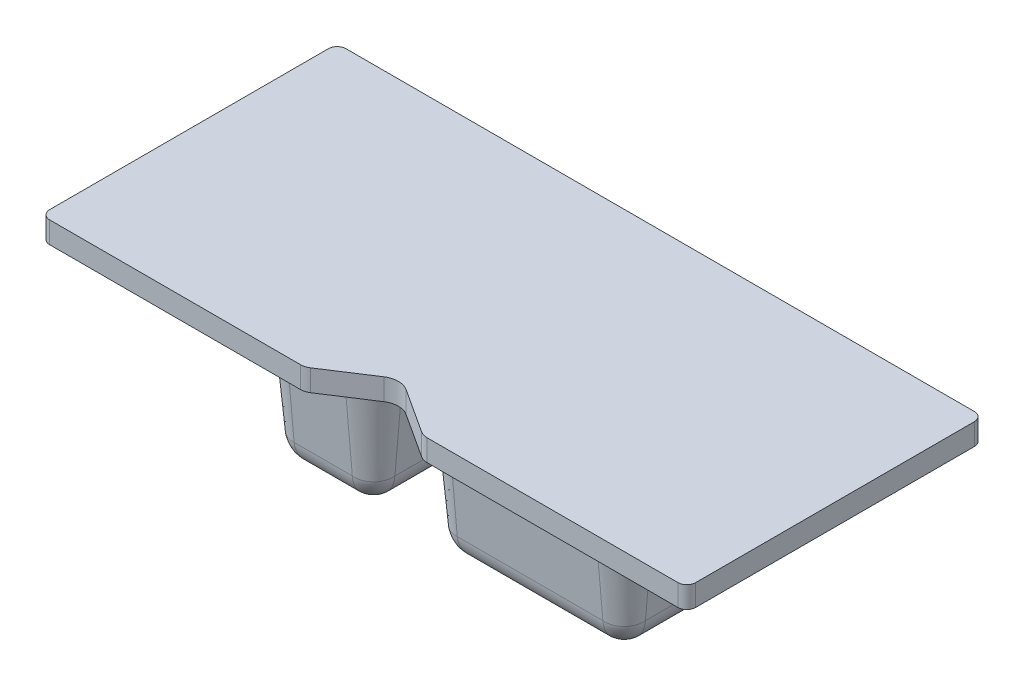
SolidWorks part; units mm, degrees
ref_plane "Front Plane" through (0, 0, 0) normal (0, 0, 1) x (1, 0, 0)
ref_plane "Top Plane" through (0, 0, 0) normal (0, 1, 0) x (1, 0, 0)
ref_plane "Right Plane" through (0, 0, 0) normal (1, 0, 0) x (0, 0, -1)
sketch "Sketch1" plane through (0, 0, 0) normal (0, 1, 0) x (1, 0, 0)
  line L1 (-560, 280) -> (560, 280)
  line L2 (-580, 260) -> (-580, -260)
  line L3 (-560, -280) -> (560, -280)
  line L4 (580, 260) -> (580, -260)
  line L5 (-580, 280) -> (580, -280) construction
  line L6 (-580, -280) -> (580, 280) construction
  arc A0 (560, 280) -> (580, 260) centre (560, 260) cw
  arc A1 (-580, -260) -> (-560, -280) centre (-560, -260) ccw
  arc A2 (-560, 280) -> (-580, 260) centre (-560, 260) ccw
  arc A3 (560, -280) -> (580, -260) centre (560, -260) ccw
  point P0 (0, 0)
  dimension "D3" = 20
  dimension "D1" = 560
  dimension "D2" = 1160
extrude "Boss-Extrude1" add sketch "Sketch1" against normal blind 5 draft 45
sketch "Sketch2" plane through (0, 0, 0) normal (0, 1, 0) x (1, 0, 0)
  line L1 (-600, 300) -> (600, 300)
  line L2 (-600, 300) -> (-600, -300)
  line L3 (-600, -300) -> (600, -300)
  line L4 (600, 300) -> (600, -300)
  line L5 (-600, 300) -> (600, -300) construction
  line L6 (-600, -300) -> (600, 300) construction
  point P0 (0, 0)
  dimension "D1" = 600
  dimension "D2" = 1200
extrude "Boss-Extrude2" add sketch "Sketch2" along normal blind 28
fillet "Fillet1" radius 2 16 edges at (-574.1421, 0, 274.1421) (-580, 0, 0) (-574.1421, 0, -274.1421) (0, 0, -280) (574.1421, 0, -274.1421) (580, 0, 0) (574.1421, 0, 274.1421) (0, -5, -275) (-570.6066, -5, -270.6066) (-575, -5, 0) (-570.6066, -5, 270.6066) (0, -5, 275) (570.6066, -5, 270.6066) (575, -5, 0) (570.6066, -5, -270.6066) (0, 0, 280)
sketch "Sketch5" plane through (0, -5, 0) normal (0, -1, 0) x (1, 0, 0)
  line L4 (-560, -274.1716) -> (560, -274.1716)
  line L5 (574.1716, -260) -> (574.1716, 260)
  line L6 (560, 274.1716) -> (-560, 274.1716)
  line L7 (-574.1716, 260) -> (-574.1716, -260)
  line L8 (-560, -274.1716) -> (560, -274.1716)
  line L9 (574.1716, -260) -> (574.1716, 260)
  line L10 (560, 274.1716) -> (-560, 274.1716)
  line L11 (-574.1716, 260) -> (-574.1716, -260)
  arc A4 (-574.1716, -260) -> (-560, -274.1716) centre (-560, -260) ccw
  arc A5 (560, -274.1716) -> (574.1716, -260) centre (560, -260) ccw
  arc A6 (574.1716, 260) -> (560, 274.1716) centre (560, 260) ccw
  arc A7 (-560, 274.1716) -> (-574.1716, 260) centre (-560, 260) ccw
  arc A8 (-574.1716, -260) -> (-560, -274.1716) centre (-560, -260) ccw
  arc A9 (560, -274.1716) -> (574.1716, -260) centre (560, -260) ccw
  arc A10 (574.1716, 260) -> (560, 274.1716) centre (560, 260) ccw
  arc A11 (-560, 274.1716) -> (-574.1716, 260) centre (-560, 260) ccw
  dimension "D1" = 0
extrude "Cut-Extrude1" cut sketch "Sketch5" against normal through all flip side to cut
sketch "Sketch6" plane through (0, -5, 0) normal (0, -1, 0) x (1, 0, 0)
  line L0 (-574.1716, 260) -> (-574.1716, -260) construction
  line L1 (539.1716, 259.1716) -> (108.8932, 259.1716)
  line L2 (559.1716, 239.1716) -> (559.1716, -239.1716)
  line L3 (539.1716, -259.1716) -> (-539.1716, -259.1716)
  line L4 (-559.1716, 239.1716) -> (-559.1716, -239.1716)
  line L5 (559.1716, 259.1716) -> (-559.1716, -259.1716) construction
  line L6 (559.1716, -259.1716) -> (-559.1716, 259.1716) construction
  line L7 (560, 274.1716) -> (-560, 274.1716) construction
  line L8 (0, 0) -> (0, 259.1716) construction
  line L9 (92.5436, 254.3249) -> (16.3497, 204.7988)
  line L10 (-16.3497, 204.7988) -> (-92.5436, 254.3249)
  line L11 (-108.8932, 259.1716) -> (-539.1716, 259.1716)
  arc A0 (-539.1716, 259.1716) -> (-559.1716, 239.1716) centre (-539.1716, 239.1716) ccw
  arc A1 (559.1716, -239.1716) -> (539.1716, -259.1716) centre (539.1716, -239.1716) cw
  arc A2 (539.1716, 259.1716) -> (559.1716, 239.1716) centre (539.1716, 239.1716) cw
  arc A3 (-539.1716, -259.1716) -> (-559.1716, -239.1716) centre (-539.1716, -239.1716) cw
  arc A4 (16.3497, 204.7988) -> (-16.3497, 204.7988) centre (0, 229.9522) cw
  arc A5 (92.5436, 254.3249) -> (108.8932, 259.1716) centre (108.8932, 229.1716) cw
  arc A6 (-92.5436, 254.3249) -> (-108.8932, 259.1716) centre (-108.8932, 229.1716) ccw
  point P0 (0, 0)
  point P29 (0, 194.1716)
  point P32 (100, 259.1716)
  point P35 (-100, 259.1716)
  dimension "D3" = 20
  dimension "D6" = 30
  dimension "D7" = 30
  dimension "D1" = 15
  dimension "D2" = 15
  dimension "D4" = 200
  dimension "D5" = 65
extrude "Boss-Extrude3" add sketch "Sketch6" along normal blind 4 draft 45
fillet "Fillet2" radius 2 28 edges at (553.3137, -5, 253.3137) (559.1716, -5, 0) (553.3137, -5, -253.3137) (0, -5, -259.1716) (-553.3137, -5, -253.3137) (-559.1716, -5, 0) (-553.3137, -5, 253.3137) (-324.0324, -5, 259.1716) (-100.3668, -5, 257.9344) (-54.4466, -5, 229.5619) (0, -5, 199.9522) (54.4466, -5, 229.5619) (100.3668, -5, 257.9344) (-324.0324, -9, 255.1716) (-101.5036, -9, 254.0993) (-56.6266, -9, 226.2081) (0, -9, 195.9522) (56.6266, -9, 226.2081) (101.5036, -9, 254.0993) (324.0324, -9, 255.1716) (550.4853, -9, 250.4853) (555.1716, -9, 0) (550.4853, -9, -250.4853) (0, -9, -255.1716) (-550.4853, -9, -250.4853) (-555.1716, -9, 0) (-550.4853, -9, 250.4853) (324.0324, -5, 259.1716)
sketch "Sketch8" plane through (0, -9, 0) normal (0, -1, 0) x (1, 0, 0)
  line L7 (-108.8932, 254.3431) -> (-539.1716, 254.3431)
  line L8 (-554.3431, 239.1716) -> (-554.3431, -239.1716)
  line L9 (-539.1716, -254.3431) -> (539.1716, -254.3431)
  line L10 (554.3431, -239.1716) -> (554.3431, 239.1716)
  line L11 (539.1716, 254.3431) -> (108.8932, 254.3431)
  line L12 (95.175, 250.2765) -> (18.9811, 200.7505)
  line L13 (-18.9811, 200.7505) -> (-95.175, 250.2765)
  line L14 (-108.8932, 254.3431) -> (-539.1716, 254.3431)
  line L15 (-554.3431, 239.1716) -> (-554.3431, -239.1716)
  line L16 (-539.1716, -254.3431) -> (539.1716, -254.3431)
  line L17 (554.3431, -239.1716) -> (554.3431, 239.1716)
  line L18 (539.1716, 254.3431) -> (108.8932, 254.3431)
  line L19 (95.175, 250.2765) -> (18.9811, 200.7505)
  line L20 (-18.9811, 200.7505) -> (-95.175, 250.2765)
  arc A7 (-95.175, 250.2765) -> (-108.8932, 254.3431) centre (-108.8932, 229.1716) ccw
  arc A8 (-539.1716, 254.3431) -> (-554.3431, 239.1716) centre (-539.1716, 239.1716) ccw
  arc A9 (-554.3431, -239.1716) -> (-539.1716, -254.3431) centre (-539.1716, -239.1716) ccw
  arc A10 (539.1716, -254.3431) -> (554.3431, -239.1716) centre (539.1716, -239.1716) ccw
  arc A11 (554.3431, 239.1716) -> (539.1716, 254.3431) centre (539.1716, 239.1716) ccw
  arc A12 (108.8932, 254.3431) -> (95.175, 250.2765) centre (108.8932, 229.1716) ccw
  arc A13 (-18.9811, 200.7505) -> (18.9811, 200.7505) centre (0, 229.9522) ccw
  arc A14 (-95.175, 250.2765) -> (-108.8932, 254.3431) centre (-108.8932, 229.1716) ccw
  arc A15 (-539.1716, 254.3431) -> (-554.3431, 239.1716) centre (-539.1716, 239.1716) ccw
  arc A16 (-554.3431, -239.1716) -> (-539.1716, -254.3431) centre (-539.1716, -239.1716) ccw
  arc A17 (539.1716, -254.3431) -> (554.3431, -239.1716) centre (539.1716, -239.1716) ccw
  arc A18 (554.3431, 239.1716) -> (539.1716, 254.3431) centre (539.1716, 239.1716) ccw
  arc A19 (108.8932, 254.3431) -> (95.175, 250.2765) centre (108.8932, 229.1716) ccw
  arc A20 (-18.9811, 200.7505) -> (18.9811, 200.7505) centre (0, 229.9522) ccw
  dimension "D1" = 0
extrude "Cut-Extrude2" cut sketch "Sketch8" against normal through all flip side to cut
sketch "Sketch9" plane through (0, -9, 0) normal (0, -1, 0) x (1, 0, 0)
  line L1 (340, 197.5) -> (90, 197.5)
  line L2 (390, 147.5) -> (390, -147.5)
  line L3 (340, -197.5) -> (90, -197.5)
  line L4 (40, 147.5) -> (40, -147.5)
  line L5 (390, 197.5) -> (40, -197.5) construction
  line L6 (390, -197.5) -> (40, 197.5) construction
  line L7 (-190, 197.5) -> (-90, 197.5)
  line L8 (-240, 147.5) -> (-240, -147.5)
  line L9 (-190, -197.5) -> (-90, -197.5)
  line L10 (-40, 147.5) -> (-40, -147.5)
  line L11 (-240, 197.5) -> (-40, -197.5) construction
  line L12 (-240, -197.5) -> (-40, 197.5) construction
  arc A0 (90, 197.5) -> (40, 147.5) centre (90, 147.5) ccw
  arc A1 (390, -147.5) -> (340, -197.5) centre (340, -147.5) cw
  arc A2 (340, 197.5) -> (390, 147.5) centre (340, 147.5) cw
  arc A3 (90, -197.5) -> (40, -147.5) centre (90, -147.5) cw
  arc A4 (-90, 197.5) -> (-40, 147.5) centre (-90, 147.5) cw
  arc A5 (-240, -147.5) -> (-190, -197.5) centre (-190, -147.5) ccw
  arc A6 (-190, 197.5) -> (-240, 147.5) centre (-190, 147.5) ccw
  arc A7 (-90, -197.5) -> (-40, -147.5) centre (-90, -147.5) ccw
  point P0 (215, 0)
  point P18 (-140, 0)
  dimension "D4" = 50
  dimension "D8" = 50
  dimension "D1" = 350
  dimension "D2" = 395
  dimension "D3" = 40
  dimension "D5" = 200
  dimension "D6" = 395
  dimension "D7" = 40
extrude "Boss-Extrude4" add sketch "Sketch9" along normal blind 200 draft 5
fillet "Fillet3" radius 50 8 edges at (-57.4977, -209, 0) (-140, -209, -180.0023) (-222.5023, -209, 0) (-140, -209, 180.0023) (215, -209, 180.0023) (372.5023, -209, 0) (215, -209, -180.0023) (57.4977, -209, 0)
sketch "Sketch10" plane through (0, -209, 0) normal (0, -1, 0) x (1, 0, 0)
  line L0 (215, 0) -> (215, -134.1857) construction
  line L1 (103.3143, -134.1857) -> (326.6857, -134.1857) construction
  line L2 (-140, -134.1857) -> (-140, 0) construction
  line L3 (-176.6857, -134.1857) -> (-103.3143, -134.1857) construction
  circle A0 centre (215, 0) radius 30
  circle A1 centre (-140, 0) radius 30
  dimension "D1" = 60
extrude "Boss-Extrude5" add sketch "Sketch10" along normal blind 10
fillet "Fillet4" radius 3 3 edges at (-140, -209, 30) (215, -209, -30) (215, -219, -30)
fillet "Fillet5" radius 20 16 edges at (40, -9, 0) (54.6447, -9, 182.8553) (215, -9, 197.5) (375.3553, -9, 182.8553) (390, -9, 0) (375.3553, -9, -182.8553) (215, -9, -197.5) (-140, -9, -197.5) (-225.3553, -9, -182.8553) (-240, -9, 0) (-225.3553, -9, 182.8553) (-140, -9, 197.5) (-54.6447, -9, 182.8553) (-40, -9, 0) (54.6447, -9, -182.8553) (-54.6447, -9, -182.8553)
sketch "Orientation Sketch" plane through (0, -9, 0) normal (0, -1, 0) x (-1, 0, 0)
  line L0 (-21.6734, 147.5) -> (-21.6734, -147.5) construction
  line L1 (-90, -215.8266) -> (-340, -215.8266) construction
  line L2 (-408.3266, -147.5) -> (-408.3266, 147.5) construction
  line L3 (-340, 215.8266) -> (-90, 215.8266) construction
  line L4 (90, 215.8266) -> (190, 215.8266) construction
  line L5 (258.3266, 147.5) -> (258.3266, -147.5) construction
  line L6 (190, -215.8266) -> (90, -215.8266) construction
  line L7 (21.6734, -147.5) -> (21.6734, 147.5) construction
  line L8 (108.8932, -254.3431) -> (539.1716, -254.3431) construction
  line L9 (554.3431, -239.1716) -> (554.3431, 239.1716) construction
  line L10 (539.1716, 254.3431) -> (-539.1716, 254.3431) construction
  line L11 (-554.3431, 239.1716) -> (-554.3431, -239.1716) construction
  line L12 (-539.1716, -254.3431) -> (-108.8932, -254.3431) construction
  line L13 (-95.175, -250.2765) -> (-18.9811, -200.7505) construction
  line L14 (18.9811, -200.7505) -> (95.175, -250.2765) construction
  line L15 (-21.6734, 147.5) -> (-21.6734, -147.5)
  line L16 (-90, -215.8266) -> (-340, -215.8266)
  line L17 (-408.3266, -147.5) -> (-408.3266, 147.5)
  line L18 (-340, 215.8266) -> (-90, 215.8266)
  line L19 (90, 215.8266) -> (190, 215.8266)
  line L20 (258.3266, 147.5) -> (258.3266, -147.5)
  line L21 (190, -215.8266) -> (90, -215.8266)
  line L22 (21.6734, -147.5) -> (21.6734, 147.5)
  line L23 (108.8932, -254.3431) -> (539.1716, -254.3431) construction
  line L24 (554.3431, -239.1716) -> (554.3431, 239.1716) construction
  line L25 (539.1716, 254.3431) -> (-539.1716, 254.3431) construction
  line L26 (-554.3431, 239.1716) -> (-554.3431, -239.1716) construction
  line L27 (-539.1716, -254.3431) -> (-108.8932, -254.3431) construction
  line L28 (-95.175, -250.2765) -> (-18.9811, -200.7505) construction
  line L29 (18.9811, -200.7505) -> (95.175, -250.2765) construction
  arc A0 (-21.6734, 147.5) -> (-90, 215.8266) centre (-90, 147.5) ccw construction
  arc A1 (-90, -215.8266) -> (-21.6734, -147.5) centre (-90, -147.5) ccw construction
  arc A2 (-408.3266, -147.5) -> (-340, -215.8266) centre (-340, -147.5) ccw construction
  arc A3 (-340, 215.8266) -> (-408.3266, 147.5) centre (-340, 147.5) ccw construction
  arc A4 (90, 215.8266) -> (21.6734, 147.5) centre (90, 147.5) ccw construction
  arc A5 (258.3266, 147.5) -> (190, 215.8266) centre (190, 147.5) ccw construction
  arc A6 (190, -215.8266) -> (258.3266, -147.5) centre (190, -147.5) ccw construction
  arc A7 (21.6734, -147.5) -> (90, -215.8266) centre (90, -147.5) ccw construction
  arc A8 (95.175, -250.2765) -> (108.8932, -254.3431) centre (108.8932, -229.1716) ccw construction
  arc A9 (539.1716, -254.3431) -> (554.3431, -239.1716) centre (539.1716, -239.1716) ccw construction
  arc A10 (554.3431, 239.1716) -> (539.1716, 254.3431) centre (539.1716, 239.1716) ccw construction
  arc A11 (-539.1716, 254.3431) -> (-554.3431, 239.1716) centre (-539.1716, 239.1716) ccw construction
  arc A12 (-554.3431, -239.1716) -> (-539.1716, -254.3431) centre (-539.1716, -239.1716) ccw construction
  arc A13 (-108.8932, -254.3431) -> (-95.175, -250.2765) centre (-108.8932, -229.1716) ccw construction
  arc A14 (18.9811, -200.7505) -> (-18.9811, -200.7505) centre (0, -229.9522) ccw construction
  arc A15 (-21.6734, 147.5) -> (-90, 215.8266) centre (-90, 147.5) ccw
  arc A16 (-90, -215.8266) -> (-21.6734, -147.5) centre (-90, -147.5) ccw
  arc A17 (-408.3266, -147.5) -> (-340, -215.8266) centre (-340, -147.5) ccw
  arc A18 (-340, 215.8266) -> (-408.3266, 147.5) centre (-340, 147.5) ccw
  arc A19 (90, 215.8266) -> (21.6734, 147.5) centre (90, 147.5) ccw
  arc A20 (258.3266, 147.5) -> (190, 215.8266) centre (190, 147.5) ccw
  arc A21 (190, -215.8266) -> (258.3266, -147.5) centre (190, -147.5) ccw
  arc A22 (21.6734, -147.5) -> (90, -215.8266) centre (90, -147.5) ccw
  arc A23 (95.175, -250.2765) -> (108.8932, -254.3431) centre (108.8932, -229.1716) ccw construction
  arc A24 (539.1716, -254.3431) -> (554.3431, -239.1716) centre (539.1716, -239.1716) ccw construction
  arc A25 (554.3431, 239.1716) -> (539.1716, 254.3431) centre (539.1716, 239.1716) ccw construction
  arc A26 (-539.1716, 254.3431) -> (-554.3431, 239.1716) centre (-539.1716, 239.1716) ccw construction
  arc A27 (-554.3431, -239.1716) -> (-539.1716, -254.3431) centre (-539.1716, -239.1716) ccw construction
  arc A28 (-108.8932, -254.3431) -> (-95.175, -250.2765) centre (-108.8932, -229.1716) ccw construction
  arc A29 (18.9811, -200.7505) -> (-18.9811, -200.7505) centre (0, -229.9522) ccw construction
  point P45 (0, 0)
other "FormTool3"
